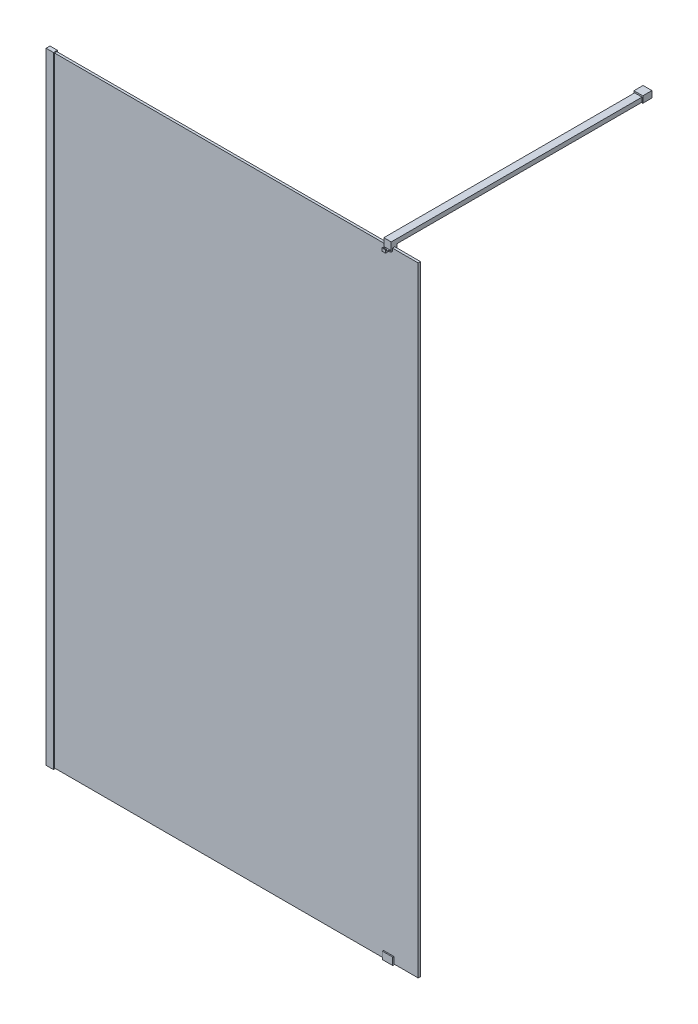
SolidWorks part; units mm, degrees
ref_plane "Płaszczyzna przednia" through (0, 0, 0) normal (0, 0, 1) x (1, 0, 0)
ref_plane "Płaszczyzna górna" through (0, 0, 0) normal (0, 1, 0) x (1, 0, 0)
ref_plane "Płaszczyzna prawa" through (0, 0, 0) normal (1, 0, 0) x (0, 0, -1)
sketch "Szkic1" plane through (0, 0, 0) normal (0, 1, 0) x (1, 0, 0)
  line L0 (0, 0) -> (0, 13.3)
  line L2 (0, 13.3) -> (25, 13.3)
  line L3 (25, 13.3) -> (25, 11.4)
  line L4 (25, 11.4) -> (11.45, 11.4)
  line L5 (11.45, 11.4) -> (11.45, 3.4)
  line L6 (11.45, 3.4) -> (25, 3.4)
  line L7 (25, 3.4) -> (25, 0)
  line L8 (25, 0) -> (0, 0)
  dimension "D1" = 13.3
  dimension "D4" = 1.9
  dimension "D5" = 8
  dimension "D6" = 3.4
  dimension "D7" = 13.55
  dimension "D8" = 25
extrude "Dodanie-wyciągnięcie1" add sketch "Szkic1" along normal blind 2100
sketch "Szkic2" plane through (0, 0, 0) normal (0, -1, 0) x (1, 0, 0)
  line L0 (11.45, -3.4) -> (1258.45, -3.4)
  line L1 (11.45, -3.4) -> (11.45, -11.4)
  line L2 (1258.45, -3.4) -> (1258.45, -11.4)
  line L3 (11.45, -11.4) -> (1258.45, -11.4)
  line L4 (11.45, -11.4) -> (25, -11.4) construction
  dimension "D1" = 1247
extrude "Dodanie-wyciągnięcie2" add sketch "Szkic2" against normal blind 2100 separate body
sketch "Szkic4" plane through (0, 2100, 0) normal (0, 1, 0) x (1, 0, 0)
  line L1 (25, 13.3) -> (0, 13.3) construction
  line L2 (25, 11.4) -> (25, 13.3) construction
  line L3 (0, 13.3) -> (0, 0) construction
  line L5 (0, 0) -> (25, 0) construction
  line L7 (25, 13.3) -> (0, 13.3)
  line L8 (25, 0) -> (25, 13.3)
  line L9 (0, 13.3) -> (0, 0)
  line L11 (0, 0) -> (25, 0)
extrude "Dodanie-wyciągnięcie3" add sketch "Szkic4" along normal blind 3
sketch "Szkic5" plane through (0, 0, 0) normal (0, -1, 0) x (1, 0, 0)
  line L1 (0, 0) -> (25, 0) construction
  line L2 (25, 0) -> (25, -3.4) construction
  line L3 (0, -13.3) -> (0, 0) construction
  line L5 (25, -13.3) -> (0, -13.3) construction
  line L7 (0, 0) -> (25, 0)
  line L8 (25, 0) -> (25, -13.3)
  line L9 (0, -13.3) -> (0, 0)
  line L11 (25, -13.3) -> (0, -13.3)
extrude "Dodanie-wyciągnięcie4" add sketch "Szkic5" along normal blind 3
ref_plane "Płaszczyzna1" through (1158.45, 0, 0) normal (1, 0, 0) x (0, 0, -1)
sketch "Szkic6" plane through (1158.45, 0, 0) normal (1, 0, 0) x (0, 0, -1)
  line L0 (11.4, 22) -> (15.75, 22)
  line L1 (15.75, 22) -> (15.75, -3)
  line L2 (15.75, -3) -> (-0.35, -3)
  line L3 (-0.35, -3) -> (-0.35, 22)
  line L4 (-0.35, 22) -> (3.4, 22)
  line L5 (11.4, 22) -> (11.4, 0)
  line L6 (11.4, 0) -> (11.4, 2100)
  line L7 (11.4, 0) -> (11.4, 2100) construction
  line L8 (3.4, 2100) -> (3.4, 0)
  line L9 (3.4, 2100) -> (3.4, 0) construction
  line L10 (11.4, 0) -> (3.4, 0)
  line L11 (3.4, 0) -> (3.4, 22)
  dimension "D1" = 4.35
  dimension "D2" = 25
  dimension "D3" = 3
  dimension "D4" = 3.75
extrude "Dodanie-wyciągnięcie5" add sketch "Szkic6" along normal mid plane 35 separate body
sketch "Szkic7" plane through (1158.45, 0, 0) normal (1, 0, 0) x (0, 0, -1)
  line L0 (3.4, 2100) -> (3.4, 0) construction
  line L1 (-0.6, 2120) -> (19.4, 2120)
  line L2 (3.4, 2100) -> (3.4, 0) construction
  line L4 (11.4, 2100) -> (3.4, 2100) construction
  line L13 (11.4, 2100) -> (11.4, 0) construction
  line L20 (19.4, 2120) -> (19.4, 2090)
  line L25 (19.4, 2090) -> (11.4, 2090)
  line L26 (11.4, 2090) -> (11.4, 2100)
  line L27 (11.4, 2100) -> (3.4, 2100)
  line L28 (3.4, 2100) -> (3.4, 2090)
  line L29 (3.4, 2090) -> (-13.37, 2090)
  line L30 (-13.37, 2090) -> (-13.37, 2100)
  line L31 (-13.37, 2100) -> (-10.37, 2100)
  line L32 (-10.37, 2100) -> (-9.8451, 2094)
  line L33 (-9.8451, 2094) -> (-0.6, 2094)
  line L34 (-0.6, 2094) -> (-0.6, 2120)
  dimension "D3" = 20
  dimension "D4" = 30
  dimension "D5" = 16.77
  dimension "D6" = 4
  dimension "D14" = 8
  dimension "D21" = 10
  dimension "D22" = 4
  dimension "D23" = 3
  dimension "D24" = 95
extrude "Dodanie-wyciągnięcie6" add sketch "Szkic7" along normal mid plane 25 separate body
sketch "Szkic8" plane through (0, 2100, 0) normal (0, 1, 0) x (1, 0, 0)
  line L0 (1145.95, -0.6) -> (1152.45, -3.631)
  line L1 (1152.45, -3.631) -> (1152.45, -13.37)
  line L2 (1170.95, -0.6) -> (1164.45, -3.631)
  line L3 (1164.45, -3.631) -> (1164.45, -13.37)
  line L4 (1158.45, -10.37) -> (1158.45, 156.6902) construction
  line L5 (1170.95, -10.37) -> (1145.95, -10.37) construction
  line L6 (1152.45, -13.37) -> (1164.45, -13.37)
  line L7 (1170.95, -13.37) -> (1145.95, -13.37) construction
  dimension "D1" = 12
  dimension "D2" = 115
extrude "Wytnij-wyciągnięcie1" cut sketch "Szkic8" against normal through all and the other way through all
sketch "Szkic10" plane through (0, 2120, 0) normal (0, 1, 0) x (1, 0, 0)
  line L0 (1158.45, 31.9) -> (1158.45, 19.4) construction
  line L1 (1145.95, 881.03) -> (1170.95, 881.03)
  line L2 (1145.95, 881.03) -> (1145.95, 19.4)
  line L3 (1145.95, 19.4) -> (1170.95, 19.4)
  line L4 (1170.95, 19.4) -> (1145.95, 19.4) construction
  line L5 (1145.95, 19.4) -> (1145.95, -0.6) construction
  line L6 (1170.95, 881.03) -> (1170.95, 19.4)
  point P4 (1158.45, 31.9)
  dimension "D2" = 861.63
  dimension "D1" = 25
  dimension "D3" = 12.5
extrude "Dodanie-wyciągnięcie7" add sketch "Szkic10" against normal blind 15
sketch "Szkic14" plane through (0, 0, -881.03) normal (0, 0, -1) x (-1, 0, 0)
  line L1 (-1173.45, 2125) -> (-1143.45, 2125)
  line L2 (-1173.45, 2125) -> (-1173.45, 2103)
  line L3 (-1173.45, 2103) -> (-1143.45, 2103)
  line L4 (-1143.45, 2125) -> (-1143.45, 2103)
  line L5 (-1173.45, 2125) -> (-1143.45, 2103) construction
  line L6 (-1173.45, 2103) -> (-1143.45, 2125) construction
  line L7 (-1158.45, 2120) -> (-1158.45, 2114) construction
  line L8 (-1170.95, 2120) -> (-1145.95, 2120) construction
  line L9 (-1170.95, 2105) -> (-1145.95, 2105) construction
  point P0 (-1158.45, 2114)
  dimension "D1" = 30
  dimension "D2" = 22
  dimension "D3" = 2
extrude "Dodanie-wyciągnięcie8" add sketch "Szkic14" against normal blind 31
